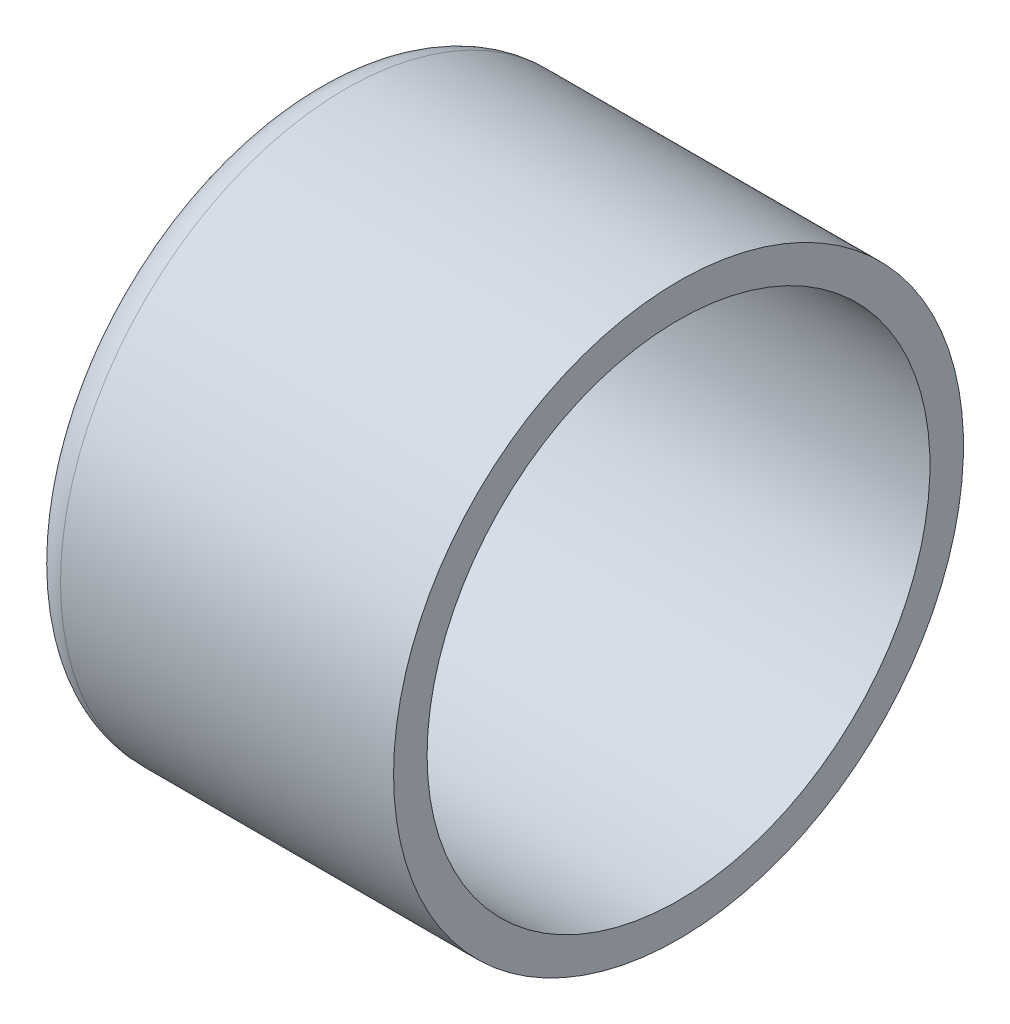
SolidWorks part; units mm, degrees
ref_plane "Plan de face" through (0, 0, 0) normal (0, 0, 1) x (1, 0, 0)
ref_plane "Plan de dessus" through (0, 0, 0) normal (0, 1, 0) x (1, 0, 0)
ref_plane "Plan de droite" through (0, 0, 0) normal (1, 0, 0) x (0, 0, -1)
sketch "Esquisse1" plane through (0, 0, 0) normal (0, 0, 1) x (1, 0, 0)
  line L0 (0, 22.5) -> (32.8, 22.5)
  line L1 (-12.6827, 0) -> (50.7306, 0) construction
  line L3 (3, 25.5) -> (32.8, 25.5)
  line L4 (32.8, 22.5) -> (32.8, 25.5)
  arc A0 (0, 22.5) -> (3, 25.5) centre (3, 22.5) cw
  dimension "D3" = 3
  dimension "D1" = 25.5
  dimension "D2" = 32.8
revolve "Révolution1" add sketch "Esquisse1" angle 360 about L1
